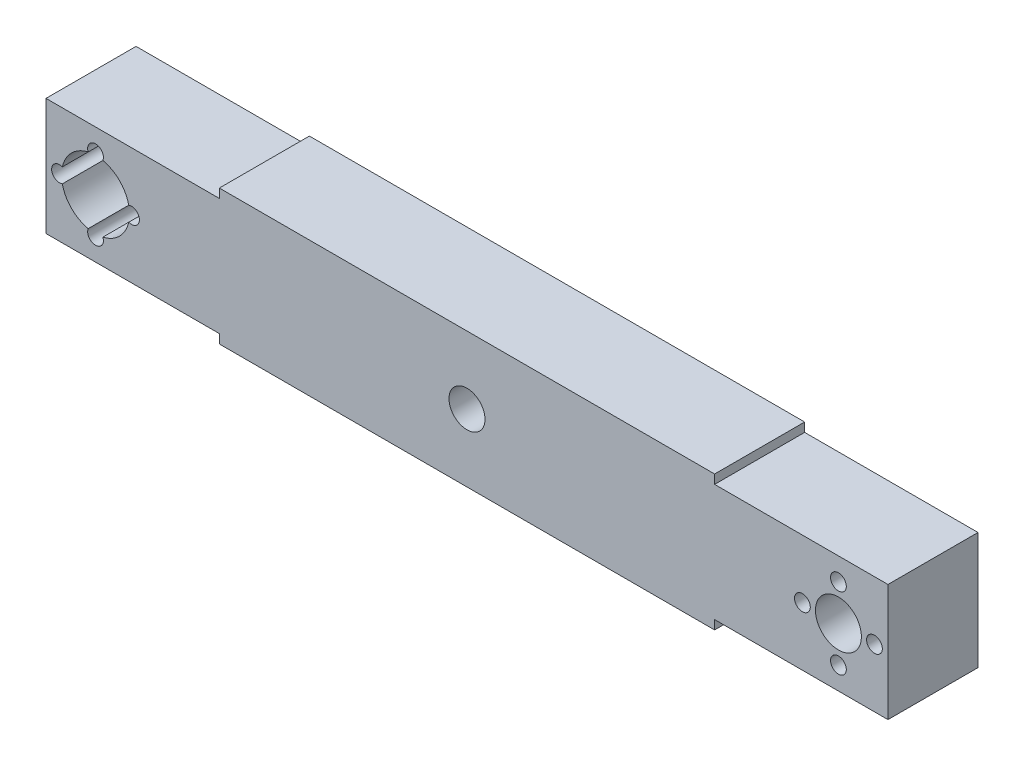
SolidWorks part; units mm, degrees
ref_plane "Front Plane" through (0, 0, 0) normal (0, 0, 1) x (1, 0, 0)
ref_plane "Top Plane" through (0, 0, 0) normal (0, 1, 0) x (1, 0, 0)
ref_plane "Right Plane" through (0, 0, 0) normal (1, 0, 0) x (0, 0, -1)
sketch "Croquis1" plane through (0, 0, 0) normal (0, 0, 1) x (1, 0, 0)
  line L1 (-55, -15) -> (55, -15)
  line L2 (-55, -15) -> (-55, 15)
  line L3 (-55, 15) -> (55, 15)
  line L4 (55, -15) -> (55, 15)
  line L5 (-55, -15) -> (55, 15) construction
  line L6 (-55, 15) -> (55, -15) construction
  point P0 (0, 0)
  dimension "D1" = 110
  dimension "D2" = 30
extrude "Saliente-Extruir1" add sketch "Croquis1" along normal blind 20
sketch "Croquis3" plane through (0, 0, 0) normal (0, 0, -1) x (-1, 0, 0)
  line L0 (-55, -15) -> (-55, 15) construction
  line L1 (-94.5, -14) -> (94.5, -14)
  line L2 (-94.5, -14) -> (-94.5, 14)
  line L3 (-94.5, 14) -> (94.5, 14)
  line L4 (94.5, -14) -> (94.5, 14)
  line L5 (-94.5, -14) -> (94.5, 14) construction
  line L6 (-94.5, 14) -> (94.5, -14) construction
  point P0 (0, 0)
  dimension "D1" = 28
  dimension "D2" = 189
  dimension "D3" = 39.5
extrude "Saliente-Extruir3" add sketch "Croquis3" against normal blind 20
sketch "Croquis4" plane through (0, 0, 0) normal (0, 0, -1) x (-1, 0, 0)
  line L0 (-82.5, 8) -> (-82.5, -8) construction
  line L1 (-94.5, 14) -> (-94.5, -14) construction
  line L2 (-55, 14) -> (-94.5, 14) construction
  line L5 (0, 0) -> (0, -48.2551) construction
  line L16 (0, 0) -> (-122.5686, 0) construction
  circle A11 centre (-82.5, 0) radius 5.1
  circle A14 centre (-82.5, 0) radius 8 construction
  circle A15 centre (-90.5, 0) radius 1.75
  circle A16 centre (-82.5, 8) radius 1.75
  circle A17 centre (-74.5, 0) radius 1.75
  circle A18 centre (-82.5, -8) radius 1.75
  circle A19 centre (82.5, -8) radius 1.75
  circle A20 centre (74.5, 0) radius 1.75
  circle A21 centre (90.5, 0) radius 1.75
  circle A22 centre (82.5, 8) radius 1.75
  circle A23 centre (82.5, 0) radius 5.1
  dimension "D1" = 10.2
  dimension "D2" = 16
  dimension "D4" = 3.5
  dimension "D6" = 3.5
  dimension "D7" = 12
  dimension "D8" = 14
  dimension "D3" = 3.5
  dimension "D5" = 3.5
extrude "Cortar-Extruir1" cut sketch "Croquis4" against normal blind 20
sketch "Sketch1" plane through (0, 0, 0) normal (0, 0, -1) x (-1, 0, 0)
  line L0 (-55, 14) -> (-94.5, 14) construction
  line L1 (-56, 13) -> (-93.5, 13)
  line L3 (-56, -13) -> (-93.5, -13)
  line L4 (-93.5, 13) -> (-93.5, -13)
  line L7 (-94.5, 14) -> (-94.5, -14) construction
  line L8 (-55, 14) -> (-55, 15) construction
  line L9 (-55, 14) -> (-94.5, 14)
  line L10 (-55, 14) -> (-55, 13)
  line L11 (-55, -14) -> (-94.5, -14)
  line L12 (-94.5, 14) -> (-94.5, -14)
  line L13 (-56, 13) -> (-55, 13)
  line L14 (-56, -13) -> (-55, -13)
  line L15 (-55, -13) -> (-55, -14)
  line L16 (0, 0) -> (0, -53.3565) construction
  line L17 (55, -13) -> (55, -14)
  line L18 (56, -13) -> (55, -13)
  line L19 (56, 13) -> (55, 13)
  line L20 (94.5, 14) -> (94.5, -14)
  line L21 (55, -14) -> (94.5, -14)
  line L22 (55, 14) -> (55, 13)
  line L23 (55, 14) -> (94.5, 14)
  line L24 (93.5, 13) -> (93.5, -13)
  line L25 (56, -13) -> (93.5, -13)
  line L26 (56, 13) -> (93.5, 13)
  point P0 (-82.5, 0)
  point P14 (-82.5, 0)
  point P34 (82.5, 0)
  dimension "D1" = 1
  dimension "D2" = 1
  dimension "D3" = 0
extrude "Cut-Extrude1" cut sketch "Sketch1" against normal up to next
sketch "Sketch2" plane through (0, 0, 0) normal (0, 0, -1) x (-1, 0, 0)
  line L0 (55, 15) -> (55, 13) construction
  line L1 (-55, 13) -> (-55, 15) construction
  circle A0 centre (0, 0) radius 4
  point P4 (-55, 14)
  dimension "D2" = 8
  dimension "D1" = 110
  dimension "D3" = 55
extrude "Cut-Extrude2" cut sketch "Sketch2" against normal up to next
sketch3d "3DSketch1"
sketch "Sketch5" plane through (0, 0, 0) normal (0, 1, 0) x (1, 0, 0)
  line L0 (0, 0) -> (0, 12.8898)
  line L1 (0, 12.8898) -> (11.1854, 0)
  line L2 (11.1854, 0) -> (0, 0)
  line L3 (55, 0) -> (-55, 0) construction
revolve "Revolve1" add sketch "Sketch5" angle 360 about L0
sketch "Sketch6" plane through (0, 0, 0) normal (0, 0, 1) x (1, 0, 0)
  circle A0 centre (0, 0) radius 3
  dimension "D1" = 6
extrude "Cut-Extrude3" cut sketch "Sketch6" against normal up to next
sketch "Sketch7" plane through (0, 0, 20) normal (0, 0, 1) x (1, 0, 0)
  circle A0 centre (-82.5, 0) radius 7.55
  dimension "D1" = 15.1
extrude "Cut-Extrude4" cut sketch "Sketch7" against normal up to next
